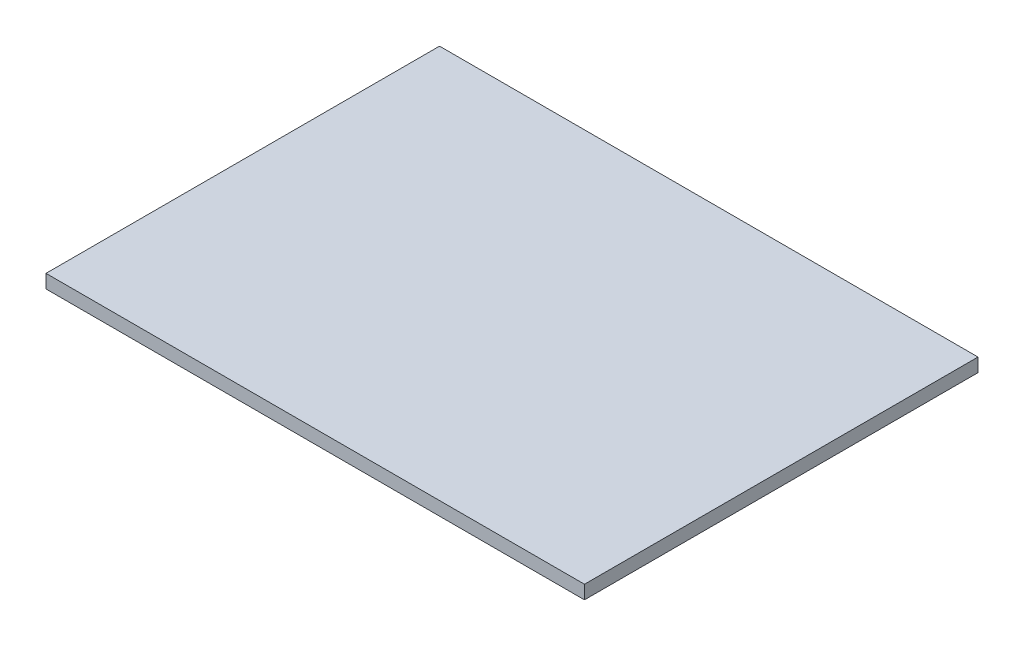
SolidWorks part; units mm, degrees
ref_plane "Спереди" through (0, 0, 0) normal (0, 0, 1) x (1, 0, 0)
ref_plane "Сверху" through (0, 0, 0) normal (0, 1, 0) x (1, 0, 0)
ref_plane "Справа" through (0, 0, 0) normal (1, 0, 0) x (0, 0, -1)
sketch "Эскиз1" plane through (0, 0, 0) normal (0, 1, 0) x (1, 0, 0)
  line L1 (39.75, -29.05) -> (-39.75, -29.05)
  line L2 (39.75, -29.05) -> (39.75, 29.05)
  line L3 (39.75, 29.05) -> (-39.75, 29.05)
  line L4 (-39.75, -29.05) -> (-39.75, 29.05)
  line L5 (39.75, -29.05) -> (-39.75, 29.05) construction
  line L6 (39.75, 29.05) -> (-39.75, -29.05) construction
  line L8 (-40, -29.3) -> (-40, -21.1) construction
  line L9 (-1.2, -29.3) -> (-40, -29.3) construction
  point P0 (0, 0)
  dimension "D1" = 0.25
  dimension "D2" = 0.25
extrude "Бобышка-Вытянуть1" add sketch "Эскиз1" along normal blind 2
